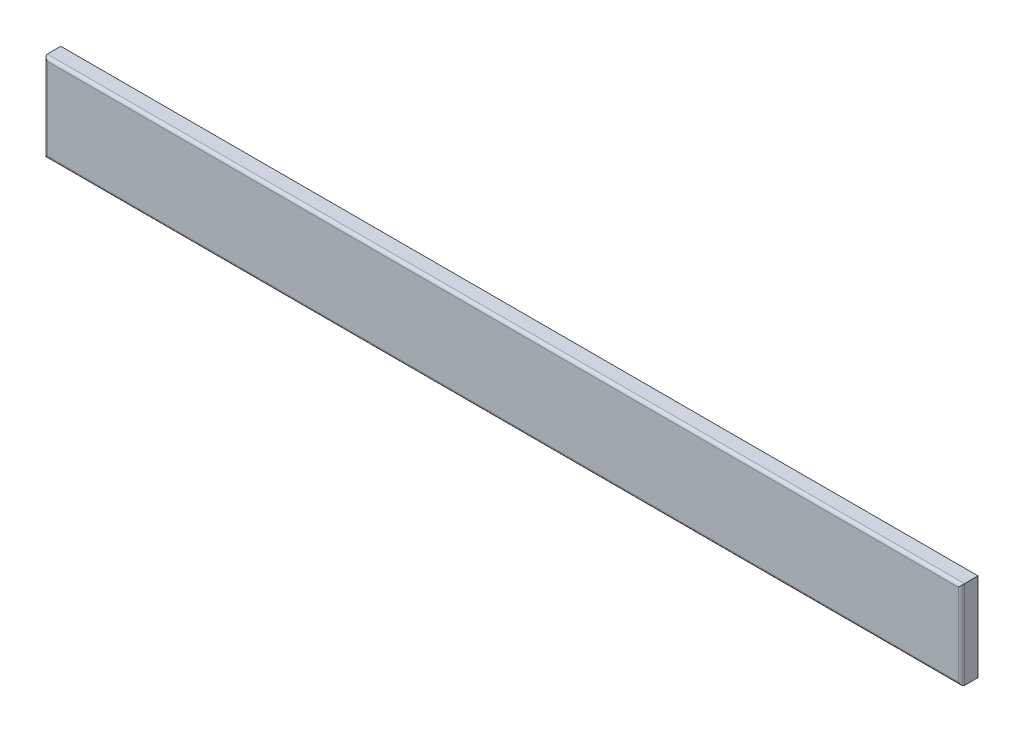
SolidWorks part; units mm, degrees
ref_plane "Спереди" through (0, 0, 0) normal (0, 0, 1) x (1, 0, 0)
ref_plane "Сверху" through (0, 0, 0) normal (0, 1, 0) x (1, 0, 0)
ref_plane "Справа" through (0, 0, 0) normal (1, 0, 0) x (0, 0, -1)
sketch "Эскиз1" plane through (0, 0, 0) normal (0, 0, 1) x (1, 0, 0)
  line L1 (-442.1, 1089.8) -> (442.1, 1089.8)
  line L2 (-442.1, 1089.8) -> (-442.1, 1004.8)
  line L3 (-442.1, 1004.8) -> (442.1, 1004.8)
  line L4 (442.1, 1089.8) -> (442.1, 1004.8)
  line L5 (-442.1, 1004.8) -> (442.1, 1004.8) construction
  line L6 (-442.1, -1004.8) -> (-442.1, 1004.8) construction
  line L7 (442.1, 1004.8) -> (442.1, -1004.8) construction
extrude "Бобышка-Вытянуть1" add sketch "Эскиз1" along normal blind 16
fillet "Скругление1" radius 3 4 edges at (442.1, 1047.3, 16) (0, 1004.8, 16) (0, 1089.8, 16) (-442.1, 1047.3, 16)
